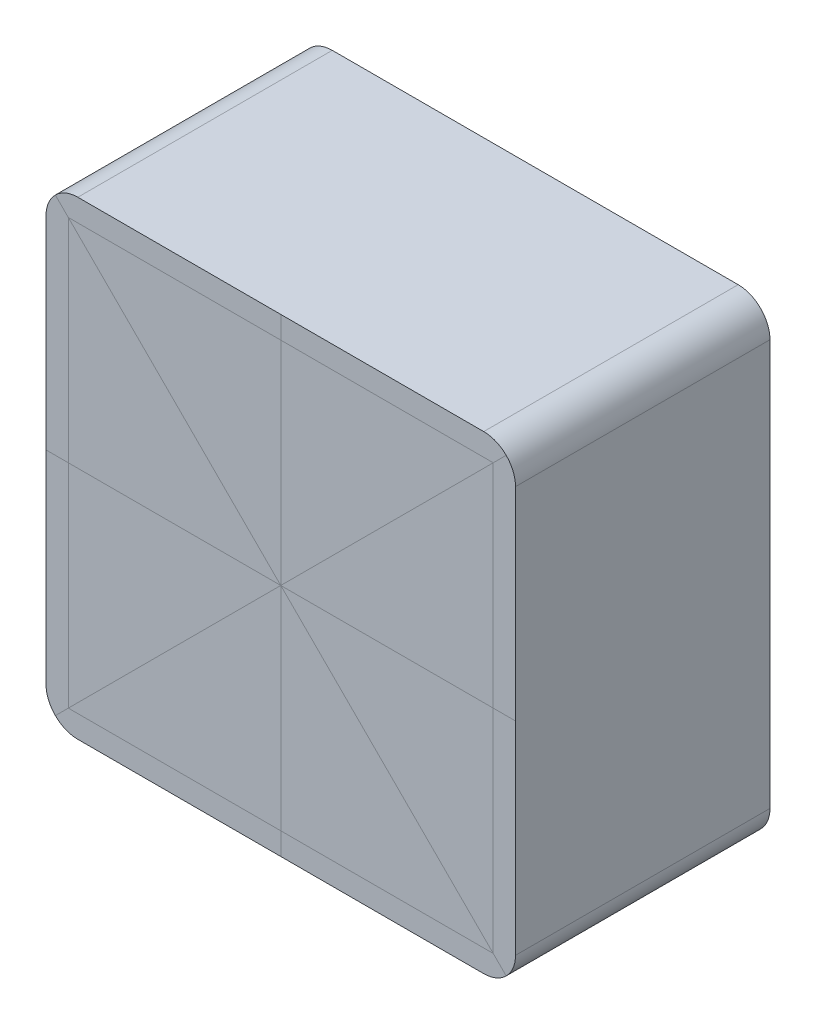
SolidWorks part; units mm, degrees
ref_plane "Front Plane" through (0, 0, 0) normal (1, 0, 0) x (0, 1, 0)
ref_plane "Top Plane" through (0, 0, 0) normal (0, 0, 1) x (0, 1, 0)
ref_plane "Right Plane" through (0, 0, 0) normal (0, 1, 0) x (-1, 0, 0)
sketch "Sketch1" plane through (0, 0, 0) normal (0, 0, 1) x (0, 1, 0)
  line L1 (-7975.6, 9225) -> (7975.6, 9225)
  line L2 (-9225, 7975.6) -> (-9225, -7975.6)
  line L3 (-7975.6, -9225) -> (7975.6, -9225)
  line L4 (9225, 7975.6) -> (9225, -7975.6)
  line L5 (-9225, 9225) -> (9225, -9225) construction
  line L6 (-9225, -9225) -> (9225, 9225) construction
  arc A0 (7975.6, -9225) -> (9225, -7975.6) centre (7975.6, -7975.6) ccw
  arc A1 (-9225, -7975.6) -> (-7975.6, -9225) centre (-7975.6, -7975.6) ccw
  arc A2 (7975.6, 9225) -> (9225, 7975.6) centre (7975.6, 7975.6) cw
  arc A3 (-7975.6, 9225) -> (-9225, 7975.6) centre (-7975.6, 7975.6) ccw
  point P0 (0, 0)
  dimension "D3" = 1249.4
  dimension "D1" = 18450
  dimension "D2" = 18450
extrude "18.45m base block" add sketch "Sketch1" along normal blind 10000
sketch "Beam Center" plane through (0, 0, 0) normal (0, 0, 1) x (0, 1, 0)
  line L5 (-8859.0592, -7750.6032) -> (-8859.0592, -8859.0592) construction
  line L6 (-8579.6592, -8030.0032) -> (-8030.0032, -8030.0032) construction
  line L10 (-8579.6592, -8030.0032) -> (-8579.6592, -8579.6592) construction
  line L11 (-8579.6592, -8579.6592) -> (-8030.0032, -8579.6592) construction
  line L12 (-8030.0032, -8030.0032) -> (-8030.0032, -8579.6592) construction
  line L13 (-8859.0592, -8859.0592) -> (-7750.6032, -8859.0592) construction
  line L14 (-7750.6032, -7750.6032) -> (-7750.6032, -8859.0592) construction
  line L15 (-8859.0592, -7750.6032) -> (-7750.6032, -7750.6032) construction
  line L17 (-8350, 8350) -> (8350, 8350)
  line L18 (-8350, 8350) -> (-8350, -8350)
  line L19 (-8350, -8350) -> (8350, -8350)
  line L20 (8350, 8350) -> (8350, -8350)
  line L21 (-8350, 8350) -> (8350, -8350) construction
  line L22 (-8350, -8350) -> (8350, 8350) construction
  arc A1 (-9225, -7975.6) -> (-7975.6, -9225) centre (-7975.6, -7975.6) ccw construction
  point P13 (-8859.0592, -8859.0592)
  point P14 (0, 0)
  dimension "D1" = 549.656
  dimension "D2" = 549.656
  dimension "D4" = 16700
  dimension "D5" = 16700
  dimension "D3" = 279.4
sketch "Sketch3" plane through (0, 0, 0) normal (0, 0, 1) x (0, 1, 0)
  line L0 (-10000, 0) -> (10000, 0)
  line L1 (-10606.6017, -10606.6017) -> (10606.6017, 10606.6017)
  line L2 (0, 9701.9517) -> (0, -9701.9517)
  line L3 (-10606.6017, 10606.6017) -> (10606.6017, -10606.6017)
  point P2 (0, 0)
  point P5 (0, 0)
  point P8 (0, 0)
  point P11 (0, 0)
  dimension "D1" = 45
  dimension "D2" = 45
